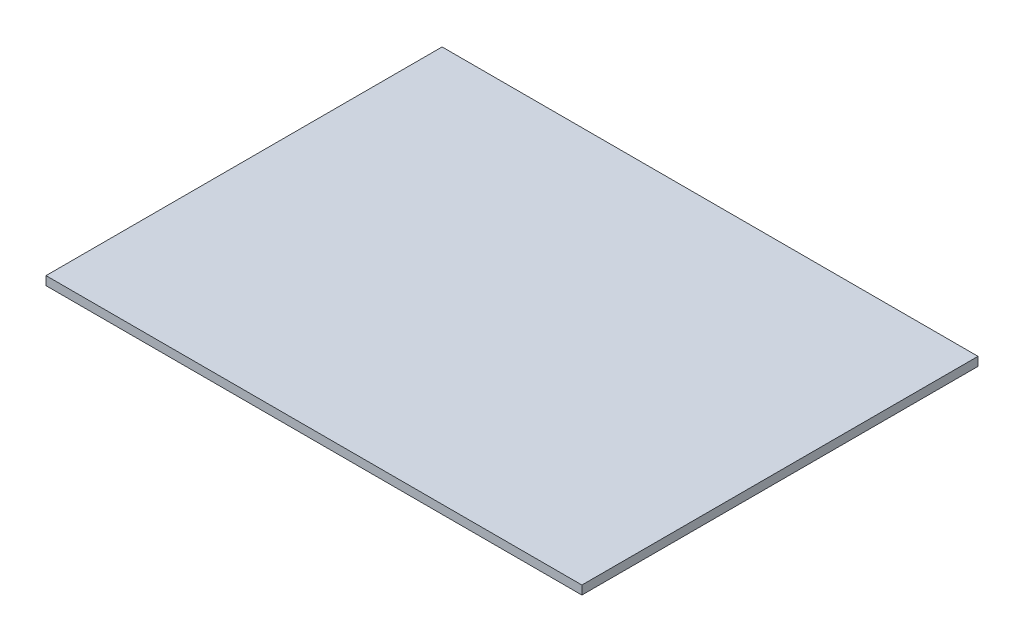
SolidWorks part; units mm, degrees
ref_plane "Front Plane" through (0, 0, 0) normal (0, 0, 1) x (1, 0, 0)
ref_plane "Top Plane" through (0, 0, 0) normal (0, 1, 0) x (1, 0, 0)
ref_plane "Right Plane" through (0, 0, 0) normal (1, 0, 0) x (0, 0, -1)
sketch "Sketch2" plane through (0, 0, 0) normal (0, 1, 0) x (1, 0, 0)
  line L1 (0, 0) -> (1168.4, 0)
  line L2 (0, 0) -> (0, 863.6)
  line L3 (0, 863.6) -> (1168.4, 863.6)
  line L4 (1168.4, 0) -> (1168.4, 863.6)
  line L5 (0, 0) -> (1168.4, 863.6) construction
  line L6 (0, 863.6) -> (1168.4, 0) construction
  point P4 (584.2, 431.8)
extrude "Boss-Extrude1" add sketch "Sketch2" along normal blind 19.05
sketch "Sketch3" plane through (0, 19.05, 0) normal (0, 1, 0) x (1, 0, 0)
  line L0 (76.2, 0) -> (76.2, -762) construction
  line L3 (1168.4, 863.6) -> (0, 863.6) construction
  circle A0 centre (203.2, 736.6) radius 51.181
  circle A1 centre (2108.2, 1238.25) radius 51.181 construction
  dimension "D1" = 127
  dimension "D2" = 127
extrude "Cut-Extrude1" [suppressed] cut sketch "Sketch3" against normal through all
equation "\"system_width\"= 7ft + 10 "
equation "\"system_length\"= 95.5"
equation "\"module_board_length\"= 11.25in"
equation "\"module_board_width\"= 1.5in"
equation "\"module_width\"= (\"system_width\" -  2* \"module_trim_thickness\") / 2"
equation "\"module_length\"= (\"system_top_length\" - \"module_trim_thickness\")/ 2"
equation "\"module_board_long_depth\"= \"module_length\" - \"module_lip_width\""
equation "\"module_board_short_depth\"= \"module_width\" - ( 2 * \"module_board_width\" ) - \"module_lip_width\""
equation "\"module_board_hole\"= 0.5in"
equation "\"module_board_hole_position\"= ( ( \"module_width\" - \"module_board_hole_seperation\" ) / 2 ) + \"module_board_width\"/2"
equation "\"module_board_hole_seperation\"= 20in"
equation "\"module_top_length\"= \"module_length\" + \"module_lip_width\""
equation "\"module_top_width\"= \"module_width\" + \"module_lip_width\""
equation "\"module_top_thickness\"= 0.75in"
equation "\"module_lip_width\"= 1.5in"
equation "\"system_step_width\"= 3ft"
equation "\"system_top_length\"= \"system_length\" - \"system_step_length\""
equation "\"module_trim_thickness\"= 1in"
equation "\"module_trim_height\"= 14in"
equation "\"D1@Sketch2\"=\"module_length\"+\"module_top_overhang\""
equation "\"D2@Sketch2\"=\"module_width\""
equation "\"module_top_overhang\"= 4.5in"
equation "\"step_board_length\"= 5.5in"
equation "\"step_board_width\"= 1.5in"
equation "\"system_step_length\"= 2ft+11.5"
equation "\"module_trim_angle\"= 45deg"
equation "\"step_module_width\"= \"module_width\""
equation "\"step_module_length\"= \"system_step_length\" - \"module_trim_thickness\""
equation "\"step_board_short_depth\"= \"step_module_length\" - \"module_lip_width\""
equation "\"step_board_long_depth\"= \"step_module_width\" - (2 * \"module_board_width\") - \"module_lip_width\""
